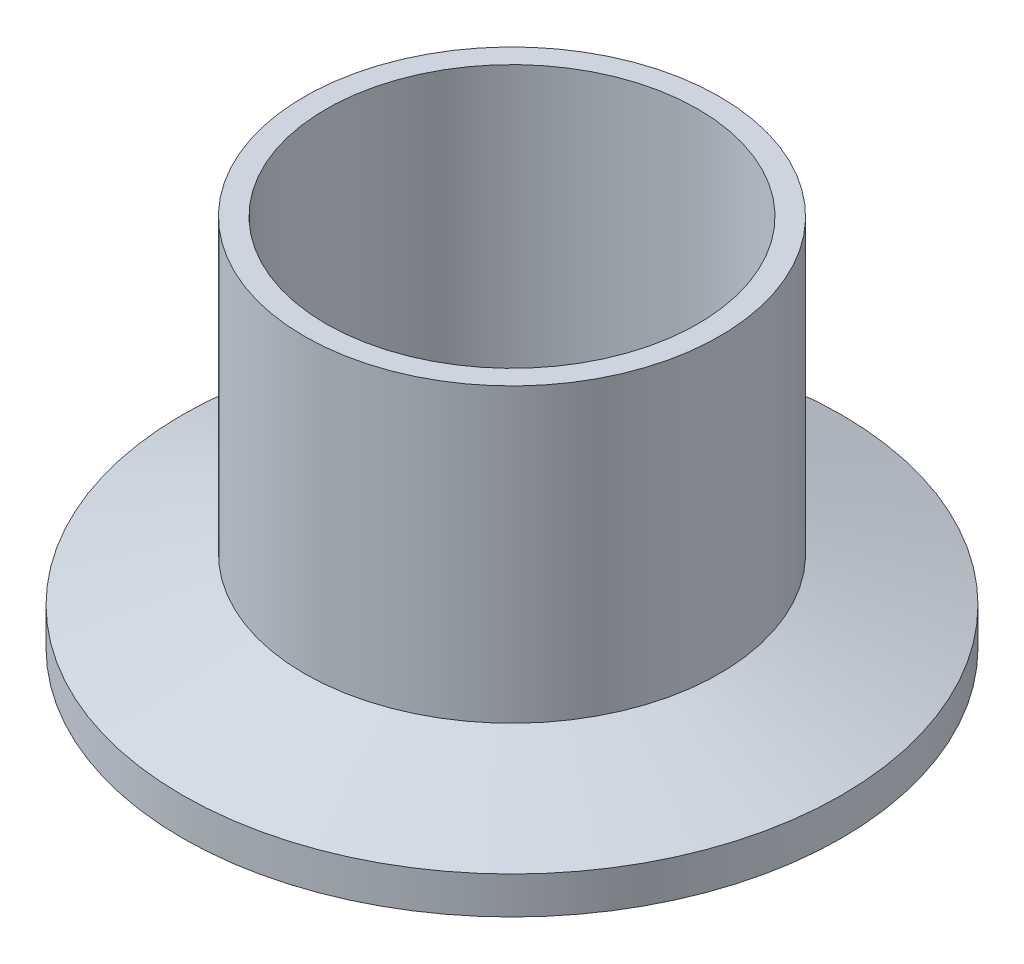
SolidWorks part; units mm, degrees
ref_plane "Front Plane" through (0, 0, 0) normal (0, 0, 1) x (1, 0, 0)
ref_plane "Top Plane" through (0, 0, 0) normal (0, 1, 0) x (1, 0, 0)
ref_plane "Right Plane" through (0, 0, 0) normal (1, 0, 0) x (0, 0, -1)
sketch "Sketch1" plane through (0, 0, 0) normal (0, 0, 1) x (1, 0, 0)
  line L0 (0, 0) -> (0, 28.575) construction
  line L1 (0, 28.575) -> (-15.875, 28.575)
  line L2 (-15.875, 28.575) -> (-15.875, 6.2377)
  line L3 (-15.875, 6.2377) -> (-25.1968, 2.8448)
  line L4 (-25.1968, 2.8448) -> (-25.1968, 0)
  line L5 (-25.1968, 0) -> (-23.9522, 0)
  line L6 (-20.0116, 0) -> (0, 0)
  line L7 (0, 0) -> (0, 28.575)
  line L8 (0, 28.575) -> (-14.224, 28.575)
  line L9 (-14.224, 28.575) -> (-14.224, 0)
  line L10 (-14.224, 0) -> (0, 0)
  line L11 (0, 0) -> (-0.1846, 0.0129)
  line L12 (-23.2507, 0.4643) -> (-23.0773, 0.8729)
  line L13 (-20.9336, 0.984) -> (-20.713, 0.4643)
  arc A0 (-23.0773, 0.8729) -> (-20.9336, 0.984) centre (-21.9784, 0.4064) cw
  arc A1 (-23.2507, 0.4643) -> (-23.9522, 0) centre (-23.9522, 0.762) cw
  arc A2 (-20.713, 0.4643) -> (-20.0116, 0) centre (-20.0116, 0.762) ccw
  point P12 (-20.6248, 0)
  dimension "D5" = 0.4064
  dimension "D10" = 1.1938
  dimension "D11" = 0.762
  dimension "D12" = 0.762
  dimension "D1" = 15.875
  dimension "D2" = 2.8448
  dimension "D3" = 25.1968
  dimension "D4" = 70
  dimension "D8" = 1.651
  dimension "D9" = 28.575
revolve "Revolve2" add sketch "Sketch1" angle 360 about L0
